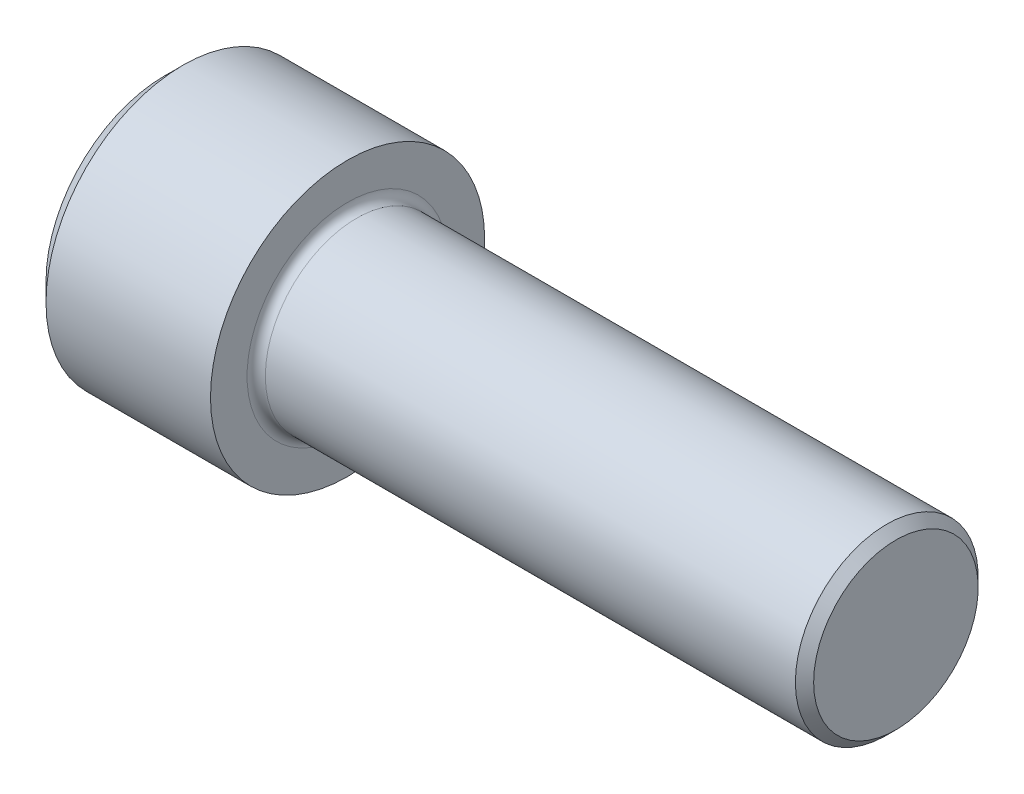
SolidWorks part; units mm, degrees
revolve "Base-Revolve" add sketch "BodySke" angle 360 about L6
sketch "BodySke" plane through (0, 0, 0) normal (0, 0, 1) x (1, 0, 0)
  line L0 (0, 0) -> (0, 16.51)
  line L1 (2.54, 19.05) -> (25.4, 19.05)
  line L2 (25.4, 19.05) -> (25.4, 12.7)
  line L3 (25.4, 12.7) -> (100.3313, 12.7)
  line L4 (101.6, 11.4313) -> (101.6, 0)
  line L5 (101.6, 0) -> (0, 0)
  line L6 (-31.75, 0) -> (127, 0) construction
  line L7 (0, 16.51) -> (2.54, 19.05)
  line L8 (101.6, 11.4313) -> (100.3313, 12.7)
  line L9 (0, -16.51) -> (2.54, -19.05) construction
  line L10 (101.6, -11.4313) -> (100.3313, -12.7) construction
  line L11 (27.5167, 9.525) -> (27.5167, 3.175) construction
  line L12 (63.5, 9.525) -> (63.5, 3.175) construction
  line L13 (63.5, 9.525) -> (63.5, 3.175) construction
  dimension "Diameter" = 25.4
  dimension "Head_ht" = 25.4
  dimension "Length" = 76.2
  dimension "Body_ch_ang" = 45
  dimension "Head_dia" = 38.1
  dimension "Head_ch_ang" = 45
  dimension "Head_side_ht" = 22.86
  dimension "Minor_dia" = 22.8625
  dimension "Advance" = 2.1167
  dimension "Thread_nom" = 38.1
  dimension "Thread_length" = 38.1
ref_plane "Plane1" through (0, 0, 0) normal (0, 0, 1) x (1, 0, 0)
ref_plane "Plane2" through (0, 0, 0) normal (0, 1, 0) x (1, 0, 0)
ref_plane "Plane3" through (0, 0, 0) normal (1, 0, 0) x (0, 0, -1)
other "Configuration Table"
fillet "Fillet1" radius 1.27 1 edges at (25.4, 0, 12.7)
sketch "Sketch2" plane through (0, 0, 0) normal (0, 0, 1) x (1, 0, 0)
  line L0 (0, 9.525) -> (12.573, 9.525)
  line L1 (12.573, 9.525) -> (18.0723, 0)
  line L2 (-31.75, 0) -> (127, 0) construction
  line L3 (18.0723, 0) -> (0, 0)
  line L4 (0, 0) -> (0, 9.525)
  line L5 (0, 16.51) -> (0, -16.51) construction
  line L6 (0, 0) -> (47.625, 0) construction
  line L7 (25.4, -19.05) -> (25.4, 19.05) construction
revolve "Hex-PreBroach" cut sketch "Sketch2" angle 360 about L6
sketch "Sketch3" plane through (0, 0, 0) normal (-1, 0, 0) x (0, 0.5, 0.866)
  line L0 (5.4993, 9.525) -> (-5.4993, 9.525)
  line L1 (-5.4993, 9.525) -> (-10.9985, 0)
  line L2 (5.4993, 9.525) -> (10.9985, 0)
  line L3 (5.4993, -9.525) -> (10.9985, 0)
  line L4 (5.4993, -9.525) -> (-5.4993, -9.525)
  line L5 (-5.4993, -9.525) -> (-10.9985, 0)
extrude "Hex" cut sketch "Sketch3" against normal blind 12.573
sketch "Sketch4" plane through (0, 0, 0) normal (-1, 0, 0) x (0, 0, 1)
  line L0 (0, 0) -> (10.1727, 0)
  line L1 (0, 0) -> (6.1484, 3.5498) construction
  line L2 (0, 0) -> (5.0863, 8.8098)
  line L3 (8.4417, 2.1022) -> (9.7612, 2.864)
  line L4 (6.0414, 6.2596) -> (7.3609, 7.0215)
  arc A0 (8.4417, 2.1022) -> (6.0414, 6.2596) centre (0, 0) ccw
  arc A1 (10.1727, 0) -> (9.7612, 2.864) centre (0, 0) ccw
  arc A2 (5.0863, 8.8098) -> (7.3609, 7.0215) centre (0, 0) cw
extrude "Spline" [suppressed] cut sketch "Sketch4" against normal blind 12.573
pattern_circular "CirPattern1" [suppressed] count 6 every 60 about axis through (-31.75, 0, 0) along (1, 0, 0)
sketch "Sketch5" plane through (0, 0, 0) normal (0, 0, 1) x (1, 0, 0)
  line L0 (-31.75, 0) -> (127, 0) construction
  line L2 (0, 16.51) -> (0, -16.51) construction
  circle A0 centre (7.874, 0) radius 1.1874
  dimension "Drilled_hole_dia" = 2.3749
  dimension "Drilled_hole_loc" = 7.874
extrude "Hole" [suppressed] cut sketch "Sketch5" against normal through all and the other way through all
pattern_circular "Drilled-4" [suppressed] count 2 every 60 about axis through (-31.75, 0, 0) along (1, 0, 0)
pattern_circular "Drilled-6" [suppressed] count 3 every 60 about axis through (-31.75, 0, 0) along (1, 0, 0)
sketch "ThdSchSke" plane through (0, 0, 0) normal (0, 0, 1) x (1, 0, 0)
  line L0 (63.5, -11.4313) -> (62.6116, -12.7)
  line L1 (63.5, -11.4313) -> (64.3884, -12.7)
  line L2 (64.3884, -12.7) -> (64.3884, -15.875)
  line L3 (-3.175, 0) -> (5.1513, 0) construction
  line L5 (64.3884, -15.875) -> (62.6116, -15.875)
  line L6 (62.6116, -15.875) -> (62.6116, -12.7)
  line L7 (0, 16.51) -> (0, -16.51) construction
revolve "ThreadSchematic" [suppressed] cut sketch "ThdSchSke" angle 360 about L3
pattern_linear "ThdSchPat" [suppressed]
equation "\"D2@Sketch3\" = \"Hex_size@Sketch3\" / 2"
equation "\"D1@Sketch3\" = \"Hex_size@Sketch3\" / 2"
equation "\"D1@Sketch2\" = \"Hex_size@Sketch3\" / 2"
equation "\"D3@Sketch4\" = \"Spline_p_dim@Sketch4\" / 2"
equation "\"Thread_minor@ThreadCosmetic\"  =  \"Minor_dia@BodySke\""
equation "\"D2@CirPattern1\" = 360 / \"Num_teeth@CirPattern1\""
equation "\"Wall_thickness@Sketch2\" = \"Head_ht@BodySke\" - \"Key_eng@Hex\""
equation "\"Thread_length@ThreadCosmetic\" = ((sgn( (\"Length@BodySke\" - \"Advance@BodySke\" ) - \"Thread_nom@BodySke\" )-1)*( (\"Length@BodySke\" - \"Advance@BodySke\" ) - \"Thread_nom@BodySke\" ))/-2+ \"Thread_nom@BodySke\""
equation "\"Thread_minor@ThdSchSke\" = \"Minor_dia@BodySke\""
equation "\"Diameter@ThdSchSke\" = \"Diameter@BodySke\""
equation "\"Overcut@ThdSchSke\" = \"Diameter@BodySke\" * 1.25"
equation "\"Start@ThdSchSke\" = \"Head_ht@BodySke\" + \"Length@BodySke\" - \"Thread_length@ThreadCosmetic\"  '---Non-countersunk---"
equation "\"Num_threads@ThdSchPat\" = int( \"Thread_length@ThreadCosmetic\" / \"Advance@BodySke\" + 0.999 )  + 1"
equation "\"Advance@ThdSchPat\" = \"Thread_length@ThreadCosmetic\" /  (\"Num_threads@ThdSchPat\" - 1) 'relax it"
equation "\"Num_threads@ThdSchPat\" = \"Num_threads@ThdSchPat\" - sgn( \"Num_threads@ThdSchPat\" - 1) '---chamfered tips only---"
